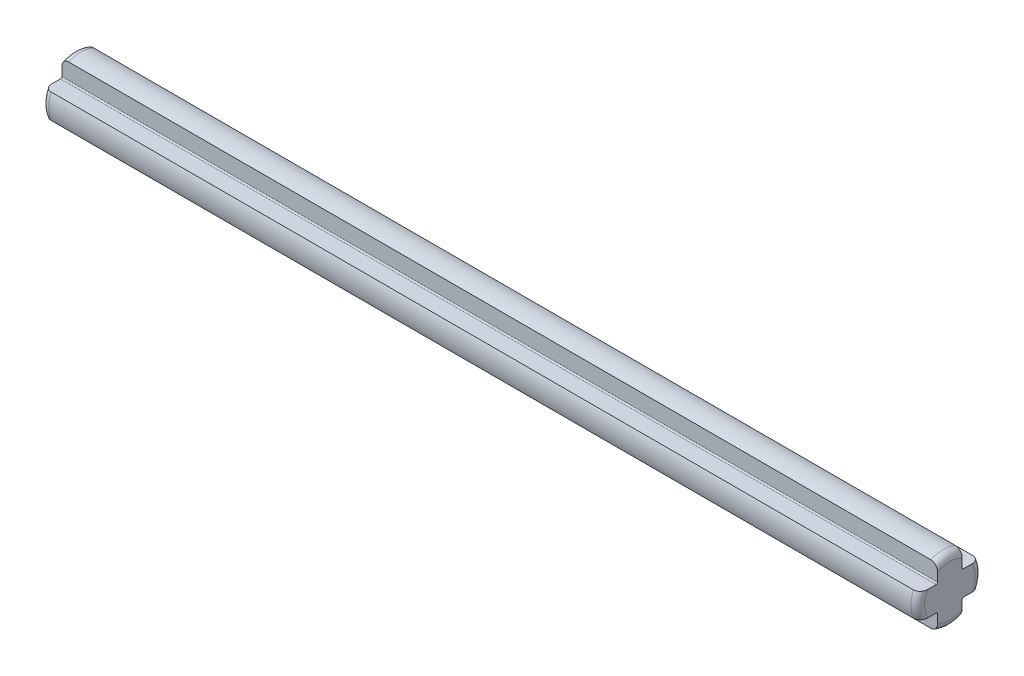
SolidWorks part; units mm, degrees
ref_plane "Alzado" through (0, 0, 0) normal (0, 0, 1) x (1, 0, 0)
ref_plane "Planta" through (0, 0, 0) normal (0, 1, 0) x (1, 0, 0)
ref_plane "Vista lateral" through (0, 0, 0) normal (1, 0, 0) x (0, 0, -1)
sketch "Croquis1" plane through (0, 0, 0) normal (1, 0, 0) x (0, 0, -1)
  line L0 (-3.7919, 0) -> (3.9132, 0) construction
  line L1 (-0.9, 2.1708) -> (-0.9, 1)
  line L2 (-2.1708, 0.9) -> (-1, 0.9)
  line L3 (2.1708, 0.9) -> (1, 0.9)
  line L4 (0.9, 2.1708) -> (0.9, 1)
  line L5 (0, 3.4809) -> (0, -0.8787) construction
  line L6 (0.9, -2.1708) -> (0.9, -1)
  line L7 (2.1708, -0.9) -> (1, -0.9)
  line L8 (-2.1708, -0.9) -> (-1, -0.9)
  line L9 (-0.9, -2.1708) -> (-0.9, -1)
  arc A0 (-2.1708, 0.9) -> (-2.1708, -0.9) centre (0, 0) ccw
  arc A1 (0.9, 2.1708) -> (-0.9, 2.1708) centre (0, 0) ccw
  arc A2 (-1, 0.9) -> (-0.9, 1) centre (-1, 1) ccw
  arc A3 (1, 0.9) -> (0.9, 1) centre (1, 1) cw
  arc A4 (2.1708, 0.9) -> (2.1708, -0.9) centre (0, 0) cw
  arc A5 (1, -0.9) -> (0.9, -1) centre (1, -1) ccw
  arc A6 (-1, -0.9) -> (-0.9, -1) centre (-1, -1) cw
  arc A7 (0.9, -2.1708) -> (-0.9, -2.1708) centre (0, 0) cw
  dimension "D1" = 2.35
  dimension "D4" = 0.1
  dimension "D2" = 1.8
  dimension "D3" = 1.8
extrude "Extruir1" add sketch "Croquis1" along normal mid plane 64
fillet "Redondeo1" radius 0.5 8 edges at (32, 2.35, 0) (32, 0, -2.35) (32, -2.35, 0) (32, 0, 2.35) (-32, -2.35, 0) (-32, 0, -2.35) (-32, 2.35, 0) (-32, 0, 2.35)
